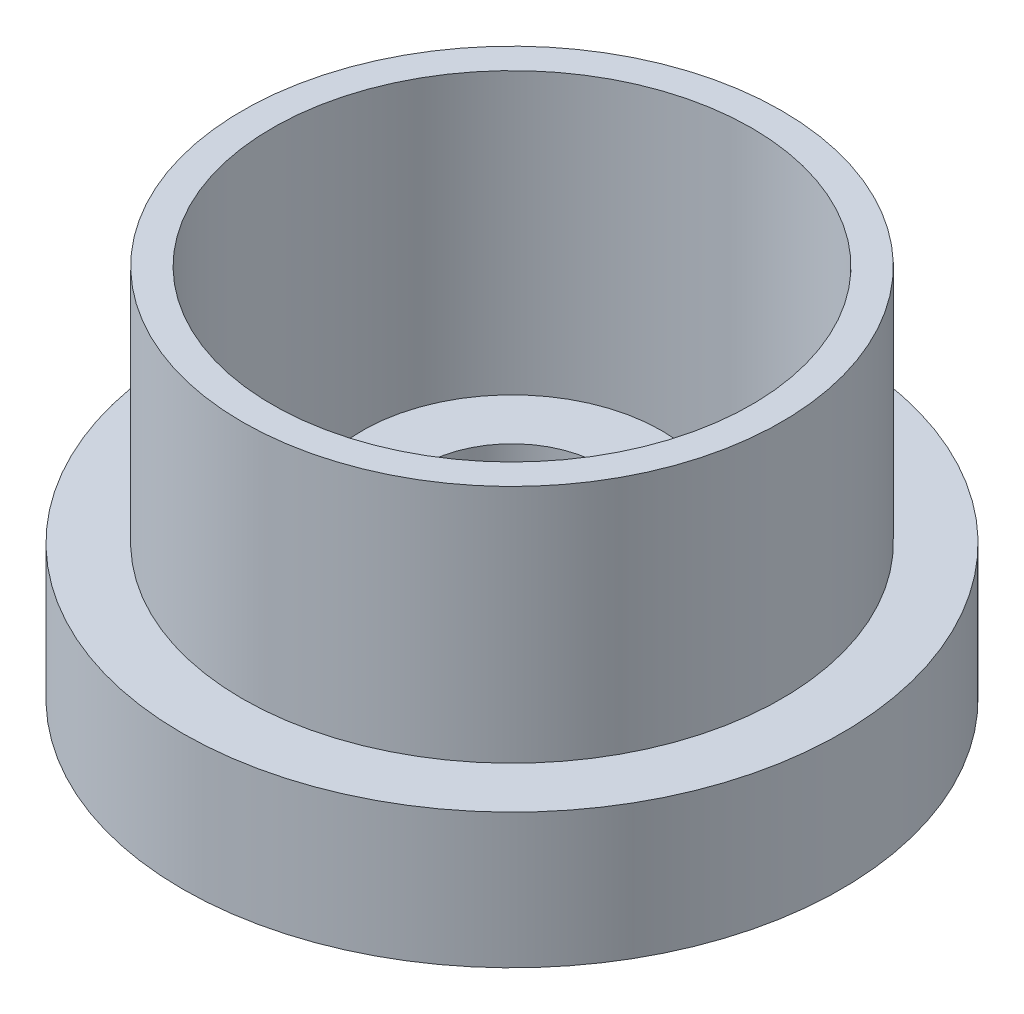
SolidWorks part; units mm, degrees
ref_plane "Face" through (0, 0, 0) normal (0, 0, 1) x (1, 0, 0)
ref_plane "Dessus" through (0, 0, 0) normal (0, 1, 0) x (1, 0, 0)
ref_plane "Droite" through (0, 0, 0) normal (1, 0, 0) x (0, 0, -1)
sketch "Esquisse1" plane through (0, 0, 0) normal (0, 0, 1) x (1, 0, 0)
  line L0 (0, -75.1045) -> (0, 86.5944) construction
  line L1 (-6, 0) -> (-6, 10.5)
  line L2 (-6, 10.5) -> (-10, 10.5)
  line L3 (-10, 10.5) -> (-10, 5)
  line L4 (-10, 5) -> (-16, 5)
  line L5 (-16, 5) -> (-16, 25)
  line L6 (-16, 25) -> (-18, 25)
  line L7 (-18, 25) -> (-18, 9)
  line L8 (-18, 9) -> (-22, 9)
  line L9 (-22, 9) -> (-22, 0)
  line L10 (-22, 0) -> (-6, 0)
  dimension "D1" = 6
  dimension "D2" = 10.5
  dimension "D3" = 10
  dimension "D4" = 16
  dimension "D5" = 18
  dimension "D6" = 22
  dimension "D7" = 9
  dimension "D8" = 5
  dimension "D9" = 25
revolve "Base-Révolution" add sketch "Esquisse1" angle 360 about L0
